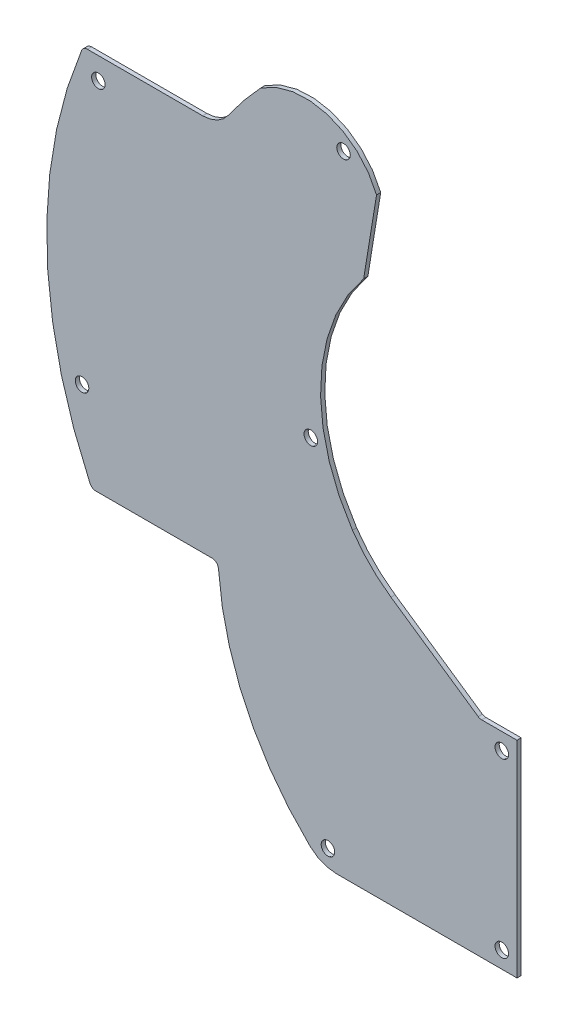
SolidWorks part; units mm, degrees
other "<TKB140221>-<<TKB140213-Z>-<圆角28>>"
ref_plane "前视基准面" through (0, 0, 0) normal (0, 0, 1) x (1, 0, 0)
ref_plane "上视基准面" through (0, 0, 0) normal (0, 1, 0) x (1, 0, 0)
ref_plane "右视基准面" through (0, 0, 0) normal (1, 0, 0) x (0, 0, -1)
inserted part "TKB140221"
sketch "草图3" plane through (0, 0, 45.3278) normal (0, 0, 1) x (1, 0, 0)
  line L0 (-286.9073, 407.6715) -> (-293.0709, 369.8636)
  line L17 (-421.2447, 217.8715) -> (-415.7123, 217.8715)
  line L18 (-415.7123, 217.8715) -> (-415.7123, 219.8715)
  line L19 (-415.7123, 219.8715) -> (-373.7123, 219.8715)
  line L20 (-373.7123, 219.8715) -> (-373.7123, 217.8715)
  line L21 (-373.7123, 217.8715) -> (-365.5397, 217.8715)
  line L22 (-306.1848, 116.8715) -> (-219.7123, 116.8715)
  line L23 (-219.7123, 116.8715) -> (-219.7123, 215.3715)
  line L24 (-219.7123, 215.3715) -> (-236.6173, 215.3715)
  line L25 (-238.3135, 215.897) -> (-280.03, 244.4924)
  line L26 (-285.0816, 239.4684) -> (-238.2568, 207.3715)
  line L27 (-238.2568, 207.3715) -> (-233.9923, 207.3715)
  line L28 (-226.9923, 200.3715) -> (-226.9923, 131.8715)
  line L29 (-233.9923, 124.8715) -> (-302.678, 124.8715)
  line L30 (-354.5942, 216.0484) -> (-354.5942, 220.8715)
  line L31 (-359.5942, 225.8715) -> (-414.7781, 225.8715)
  line L32 (-409.4862, 390.8715) -> (-360.37, 390.8715)
  line L33 (-370.067, 398.8715) -> (-425.2117, 398.8715)
  line L34 (-421.2447, 217.8715) -> (-373.7123, 217.8715)
  line L38 (-373.7123, 217.8715) -> (-365.5397, 217.8715)
  line L39 (-306.1848, 116.8715) -> (-219.7123, 116.8715)
  line L40 (-219.7123, 116.8715) -> (-219.7123, 215.3715)
  line L41 (-219.7123, 215.3715) -> (-236.6173, 215.3715)
  line L42 (-238.3135, 215.897) -> (-280.03, 244.4924)
  line L50 (-370.067, 398.8715) -> (-425.2117, 398.8715)
  arc A48 (-362.5468, 215.0784) -> (-365.5397, 217.8715) centre (-365.5397, 214.8715) ccw
  arc A49 (-362.5468, 215.0784) -> (-318.5671, 121.807) centre (-220.8849, 224.8711) ccw
  arc A50 (-318.5671, 121.807) -> (-306.1848, 116.8715) centre (-306.1848, 134.8715) ccw
  arc A51 (-238.3135, 215.897) -> (-236.6173, 215.3715) centre (-236.6173, 218.3715) ccw
  arc A52 (-298.4434, 263.0245) -> (-280.03, 244.4924) centre (-240.4527, 302.23) ccw
  arc A53 (-293.0709, 369.8636) -> (-298.4434, 263.0245) centre (-224.7123, 312.8715) ccw
  arc A54 (-293.0709, 369.8636) -> (-292.2455, 374.8628) centre (-296.9113, 373.0654) ccw
  arc A55 (-292.2455, 374.8628) -> (-297.4258, 375.6097) centre (-295.045, 373.7844) ccw
  arc A56 (-298.2526, 374.5791) -> (-297.4258, 375.6097) centre (-321.2339, 393.8627) ccw
  arc A57 (-298.2526, 374.5791) -> (-319.8351, 299.9235) centre (-224.7123, 312.8715) ccw
  arc A58 (-321.0456, 297.8085) -> (-319.8351, 299.9235) centre (-321.8168, 299.6538) ccw
  arc A59 (-321.0456, 297.8085) -> (-317.9547, 284.3608) centre (-318.3464, 291.3498) ccw
  arc A60 (-315.9422, 282.9865) -> (-317.9547, 284.3608) centre (-317.8428, 282.3639) ccw
  arc A61 (-315.9422, 282.9865) -> (-298.2526, 251.1639) centre (-224.7123, 312.8715) ccw
  arc A62 (-298.2526, 251.1639) -> (-285.0816, 239.4684) centre (-239.8851, 303.631) ccw
  arc A63 (-233.9923, 207.3715) -> (-226.9923, 200.3715) centre (-226.9923, 207.3715) ccw
  arc A64 (-226.9923, 131.8715) -> (-233.9923, 124.8715) centre (-226.9923, 124.8715) ccw
  arc A65 (-302.678, 124.8715) -> (-315.8163, 130.2981) centre (-310.1613, 125.3715) ccw
  arc A66 (-354.5942, 216.0484) -> (-315.8163, 130.2981) centre (-220.8849, 224.8711) ccw
  arc A67 (-354.5942, 220.8715) -> (-359.5942, 225.8715) centre (-359.5942, 220.8715) ccw
  arc A68 (-419.369, 228.8908) -> (-414.7781, 225.8715) centre (-414.7781, 230.8715) ccw
  arc A69 (-426.5747, 248.0983) -> (-419.369, 228.8908) centre (-224.7123, 312.8715) ccw
  arc A70 (-424.881, 251.7804) -> (-426.5747, 248.0983) centre (-423.7182, 249.0149) ccw
  arc A71 (-424.881, 251.7804) -> (-428.7112, 266.137) centre (-427.7882, 258.694) ccw
  arc A72 (-432.0139, 268.4861) -> (-428.7112, 266.137) centre (-429.0804, 269.1142) ccw
  arc A73 (-426.0218, 379.3431) -> (-432.0139, 268.4861) centre (-224.7123, 312.8715) ccw
  arc A74 (-422.2587, 381.2598) -> (-426.0218, 379.3431) centre (-423.1731, 378.4025) ccw
  arc A75 (-422.2587, 381.2598) -> (-412.4823, 388.0233) centre (-419.9727, 388.4029) ccw
  arc A76 (-409.4862, 390.8715) -> (-412.4823, 388.0233) centre (-409.4862, 387.8715) ccw
  arc A77 (-360.37, 390.8715) -> (-357.7942, 392.3335) centre (-360.37, 393.8715) ccw
  arc A78 (-338.0455, 418.6097) -> (-357.7942, 392.3335) centre (-224.7123, 312.8715) ccw
  arc A79 (-337.4762, 419.0855) -> (-338.0455, 418.6097) centre (-335.852, 416.5632) ccw
  arc A80 (-312.1621, 422.4582) -> (-337.4762, 419.0855) centre (-321.2339, 393.8627) ccw
  arc A81 (-310.1101, 419.1052) -> (-312.1621, 422.4582) centre (-313.0693, 419.5987) ccw
  arc A82 (-310.1101, 419.1052) -> (-299.6413, 411.029) centre (-302.7123, 417.8715) ccw
  arc A83 (-295.8773, 409.8953) -> (-299.6413, 411.029) centre (-298.413, 408.292) ccw
  arc A84 (-292.8445, 403.5601) -> (-295.8773, 409.8953) centre (-321.2339, 393.8627) ccw
  arc A85 (-292.8445, 403.5601) -> (-287.6948, 402.6166) centre (-290.0055, 404.5299) ccw
  arc A86 (-287.6948, 402.6166) -> (-286.9073, 407.6715) centre (-291.546, 405.8054) ccw
  arc A87 (-286.9073, 407.6715) -> (-295.768, 420.7046) centre (-321.2339, 393.8627) ccw
  arc A88 (-295.768, 420.7046) -> (-301.7345, 425.3075) centre (-302.7123, 417.8715) ccw
  arc A89 (-301.7345, 425.3075) -> (-342.3651, 424.235) centre (-321.2339, 393.8627) ccw
  arc A90 (-342.3651, 424.235) -> (-357.7488, 405.3122) centre (-224.7123, 312.8715) ccw
  arc A91 (-370.067, 398.8715) -> (-357.7488, 405.3122) centre (-370.067, 413.8715) ccw
  arc A92 (-425.2117, 398.8715) -> (-427.9836, 397.0189) centre (-425.2117, 395.8715) ccw
  arc A93 (-427.9836, 397.0189) -> (-444.7123, 312.8715) centre (-224.7123, 312.8715) ccw
  arc A94 (-444.7123, 312.8715) -> (-423.9618, 219.5996) centre (-224.7123, 312.8715) ccw
  arc A95 (-423.9618, 219.5996) -> (-421.2447, 217.8715) centre (-421.2447, 220.8715) ccw
  arc A96 (-362.5468, 215.0784) -> (-365.5397, 217.8715) centre (-365.5397, 214.8715) ccw
  arc A97 (-362.5468, 215.0784) -> (-318.5671, 121.807) centre (-220.8849, 224.8711) ccw
  arc A98 (-318.5671, 121.807) -> (-306.1848, 116.8715) centre (-306.1848, 134.8715) ccw
  arc A99 (-238.3135, 215.897) -> (-236.6173, 215.3715) centre (-236.6173, 218.3715) ccw
  arc A100 (-298.4434, 263.0245) -> (-280.03, 244.4924) centre (-240.4527, 302.23) ccw
  arc A101 (-293.0709, 369.8636) -> (-298.4434, 263.0245) centre (-224.7123, 312.8715) ccw
  arc A135 (-286.9073, 407.6715) -> (-295.768, 420.7046) centre (-321.2339, 393.8627) ccw
  arc A137 (-295.768, 420.7046) -> (-342.3651, 424.235) centre (-321.2339, 393.8627) ccw
  arc A138 (-342.3651, 424.235) -> (-357.7488, 405.3122) centre (-224.7123, 312.8715) ccw
  arc A139 (-370.067, 398.8715) -> (-357.7488, 405.3122) centre (-370.067, 413.8715) ccw
  arc A140 (-425.2117, 398.8715) -> (-427.9836, 397.0189) centre (-425.2117, 395.8715) ccw
  arc A141 (-427.9836, 397.0189) -> (-444.7123, 312.8715) centre (-224.7123, 312.8715) ccw
  arc A142 (-444.7123, 312.8715) -> (-423.9618, 219.5996) centre (-224.7123, 312.8715) ccw
  arc A143 (-423.9618, 219.5996) -> (-421.2447, 217.8715) centre (-421.2447, 220.8715) ccw
  dimension "D1" = 0
extrude "凸台-拉伸1" add sketch "草图3" along normal blind 2 separate body
hole_wizard "Ø6.5 (6.5) 直径孔1" positions "草图7" profile "草图8" hole size "Ø6.5" standard "ISO"
sketch "草图7" plane through (0, 0, 47.3278) normal (0, 0, 1) x (1, 0, 0)
  point P0 (-302.7123, 417.8715)
  point P3 (-419.9727, 388.4029)
  point P6 (-427.7882, 258.694)
  point P9 (-318.3464, 291.3498)
  point P12 (-226.9923, 207.3715)
  point P15 (-226.9923, 124.8715)
  point P18 (-310.1613, 125.3715)
sketch "草图8" plane through (-302.7123, 417.8715, 47.3278) normal (1, 0, 0) x (0, -1, 0)
  line L0 (0, 0) -> (0, 14.9528)
  line L1 (0, 14.9528) -> (3.25, 13)
  line L2 (3.25, 13) -> (3.25, 0)
  line L5 (3.25, 0) -> (0, 0)
  line L10 (0, 14.9528) -> (-3.25, 13) construction
  line L11 (0, -6.35) -> (0, 107.95) construction
  dimension "孔直径" = 6.5
  dimension "孔深度" = 13
  dimension "导头角度" = 118
hole_wizard "Ø5.5 (5.5) 直径孔3" positions "草图15" profile "草图16" hole size "Ø5.5" standard "GB"
sketch "草图15" plane through (-224.7123, 116.8715, -218.6722) normal (0, -1, 0) x (1, 0, 0)
  point P0 (19.2182, 278.5)
  point P3 (16.7314, 221)
  point P6 (76.7314, 221)
  point P9 (89.3663, 238)
sketch "草图16" plane through (-205.4941, 116.8715, 59.8278) normal (0, 1, 0) x (0, 0, -1)
  line L0 (0, 0) -> (0, 14.6524)
  line L1 (0, 14.6524) -> (2.75, 13)
  line L2 (2.75, 13) -> (2.75, 0)
  line L3 (2.75, 0) -> (0, 0)
  line L4 (0, 14.6524) -> (-2.75, 13) construction
  line L5 (0, -6.35) -> (0, 107.95) construction
  dimension "孔直径" = 5.5
  dimension "孔深度" = 13
  dimension "导头角度" = 118
hole_wizard "Ø5.5 (5.5) 直径孔4" positions "草图17" profile "草图18" hole size "Ø5.5" standard "GB"
sketch "草图17" plane through (-224.7123, 182.4593, -218.6722) normal (0, -1, 0) x (1, 0, 0)
  point P0 (42.5173, 315.8551)
  point P3 (110.0673, 276.8551)
sketch "草图18" plane through (-182.195, 182.4593, 97.1829) normal (0, 1, 0) x (0, 0, -1)
  line L0 (0, 0) -> (0, 14.6524)
  line L1 (0, 14.6524) -> (2.75, 13)
  line L2 (2.75, 13) -> (2.75, 0)
  line L3 (2.75, 0) -> (0, 0)
  line L4 (0, 14.6524) -> (-2.75, 13) construction
  line L5 (0, -6.35) -> (0, 107.95) construction
  dimension "孔直径" = 5.5
  dimension "孔深度" = 13
  dimension "导头角度" = 118
hole_wizard "Ø8.0 (8) 直径孔1" positions "草图19" profile "草图20" hole size "Ø8.0" standard "GB"
sketch "草图19" plane through (-224.7123, 116.8715, -218.6722) normal (0, -1, 0) x (1, 0, 0)
  point P0 (19.2182, 278.5)
  point P3 (16.7314, 221)
  point P6 (76.7314, 221)
  point P9 (89.3663, 238)
sketch "草图20" plane through (-205.4941, 116.8715, 59.8278) normal (1, 0, 0) x (0, 0, -1)
  line L0 (0, 0) -> (0, 4.4034)
  line L1 (0, 4.4034) -> (4, 2)
  line L2 (4, 2) -> (4, 0)
  line L3 (4, 0) -> (0, 0)
  line L4 (0, 4.4034) -> (-4, 2) construction
  line L5 (0, -6.35) -> (0, 107.95) construction
  dimension "孔直径" = 8
  dimension "孔深度" = 2
  dimension "导头角度" = 118
hole_wizard "Ø8.0 (8) 直径孔2" positions "草图21" profile "草图22" hole size "Ø8.0" standard "GB"
sketch "草图21" plane through (-224.7123, 182.8704, -218.6722) normal (0, -1, 0) x (1, 0, 0)
  point P0 (42.5173, 315.8551)
  point P3 (110.0673, 276.8551)
sketch "草图22" plane through (-182.195, 182.8704, 97.1829) normal (1, 0, 0) x (0, 0, -1)
  line L0 (0, 0) -> (0, 4.4034)
  line L1 (0, 4.4034) -> (4, 2)
  line L2 (4, 2) -> (4, 0)
  line L3 (4, 0) -> (0, 0)
  line L4 (0, 4.4034) -> (-4, 2) construction
  line L5 (0, -6.35) -> (0, 107.95) construction
  dimension "孔直径" = 8
  dimension "孔深度" = 2
  dimension "导头角度" = 118
